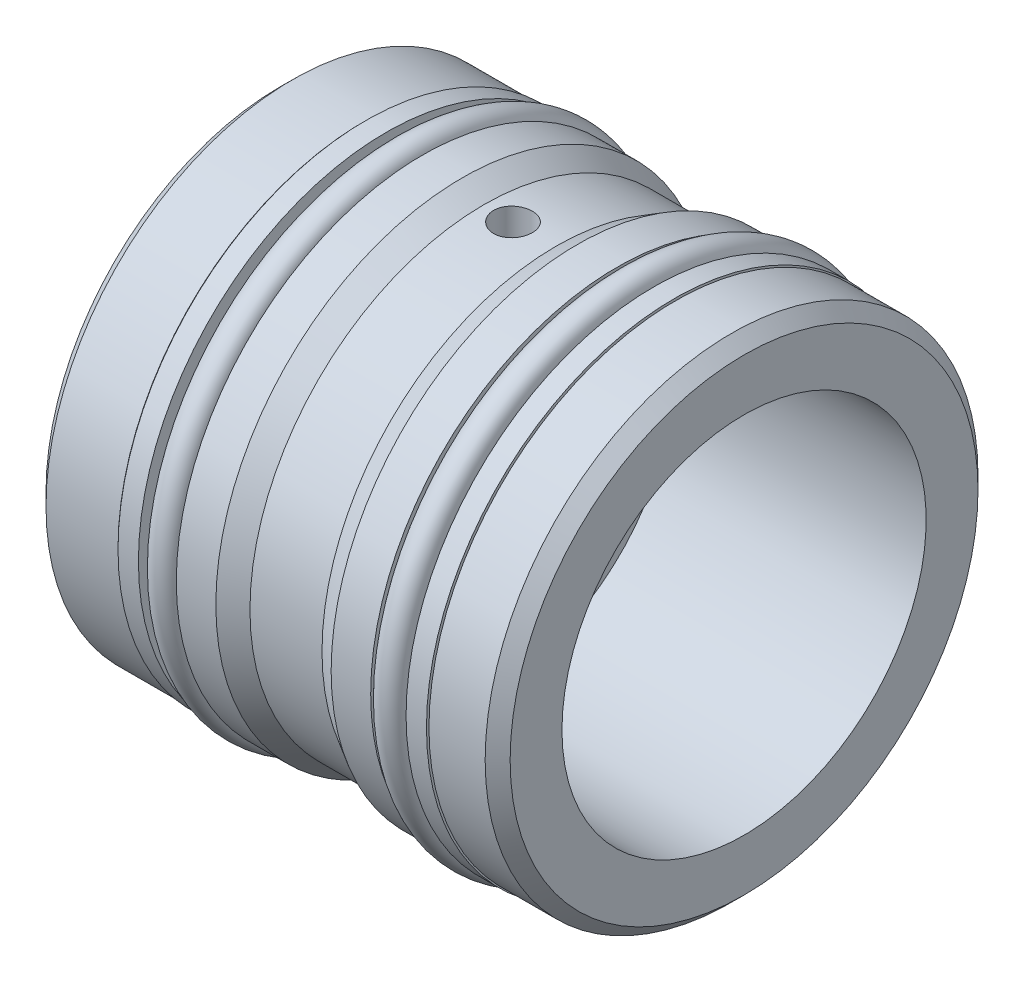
SolidWorks part; units mm, degrees
ref_plane "Front Plane" through (0, 0, 0) normal (0, 0, 1) x (1, 0, 0)
ref_plane "Top Plane" through (0, 0, 0) normal (0, 1, 0) x (1, 0, 0)
ref_plane "Right Plane" through (0, 0, 0) normal (1, 0, 0) x (0, 0, -1)
sketch "Sketch1" plane through (0, 0, 0) normal (0, 0, 1) x (1, 0, 0)
  line L0 (0, 0) -> (0, 45.5562) construction
  line L1 (0, 0) -> (32.8567, 0) construction
  line L2 (-14.1605, 6.35) -> (-14.1605, 15.0368)
  line L3 (-14.1605, 15.0368) -> (-9.0043, 15.0368)
  line L4 (-9.0043, 15.0368) -> (-9.0043, 13.7668)
  line L5 (-9.0043, 13.7668) -> (-5.4483, 13.7668)
  line L6 (-5.4483, 13.7668) -> (-5.4483, 15.0368)
  line L7 (-5.4483, 15.0368) -> (-3.0353, 15.0368)
  line L8 (-3.0353, 15.0368) -> (-3.0353, 14.2748)
  line L9 (-3.0353, 14.2748) -> (4.0005, 14.2748)
  line L10 (-14.1605, 6.35) -> (-1.2319, 6.35)
  line L11 (-1.2319, 6.35) -> (-1.2319, 11.1125)
  line L12 (-1.2319, 11.1125) -> (14.1605, 11.1125)
  line L13 (4.0005, 15.0368) -> (4.0005, 14.2748)
  line L14 (6.4135, 15.0368) -> (4.0005, 15.0368)
  line L15 (6.4135, 13.7668) -> (6.4135, 15.0368)
  line L16 (9.9695, 13.7668) -> (6.4135, 13.7668)
  line L17 (9.9695, 15.0368) -> (9.9695, 13.7668)
  line L18 (14.1605, 15.0368) -> (9.9695, 15.0368)
  line L19 (14.1605, 15.0368) -> (14.1605, 11.1125)
  dimension "D2" = 3.556
  dimension "D3" = 7.0358
  dimension "D4" = 30.0736
  dimension "D5" = 28.321
  dimension "D6" = 22.225
  dimension "D7" = 15.3924
  dimension "D8" = 28.5496
  dimension "D9" = 27.5336
  dimension "D10" = 12.7
  dimension "D11" = 23.1648
  dimension "D12" = 2.413
  dimension "D13" = 2.413
revolve "Revolve1" add sketch "Sketch1" angle 360 about L1
fillet "Fillet1" radius 0.381 2 edges at (4.0005, 0, 14.2748) (-3.0353, 0, 14.2748)
chamfer "Chamfer1" distance 0.762 angle 45 2 edges at (14.1605, 0, 15.0368) (-14.1605, 0, 15.0368)
sketch "Sketch6" plane through (0, 0, 0) normal (0, 0, 1) x (1, 0, 0)
  line L0 (0, 0) -> (49.5791, 0) construction
  line L1 (-14.1605, 14.2748) -> (-14.1605, -14.2748) construction
  line L2 (-5.4483, 13.7668) -> (-9.0043, 13.7668) construction
  line L3 (-8.9281, 13.7668) -> (-7.6835, 13.7668)
  line L4 (-8.9281, 13.7668) -> (-8.9281, 15.113)
  line L5 (-8.9281, 15.113) -> (-7.6835, 15.113)
  line L6 (-7.6835, 13.7668) -> (-7.6835, 15.113)
  line L7 (0.4826, 41.4439) -> (0.4826, -9.3524) construction
  line L8 (-9.0043, -15.0368) -> (-9.0043, 15.0368) construction
  line L9 (9.9695, 13.7668) -> (9.9695, -13.7668) construction
  line L10 (-5.4483, 15.0368) -> (-5.4483, -15.0368) construction
  line L11 (8.6487, 13.7668) -> (8.6487, 15.113)
  line L12 (9.8933, 15.113) -> (8.6487, 15.113)
  line L13 (9.8933, 13.7668) -> (9.8933, 15.113)
  line L14 (9.8933, 13.7668) -> (8.6487, 13.7668)
  circle A0 centre (-6.4135, 14.5796) radius 0.889
  circle A1 centre (7.3787, 14.5796) radius 0.889
  dimension "D4" = 1.778
  dimension "D5" = 29.1592
  dimension "D6" = 0.9652
  dimension "D1" = 1.2446
  dimension "D2" = 5.2324
  dimension "D3" = 30.226
revolve "Revolve3" add sketch "Sketch6" angle 360 about L0
sketch "Sketch7" plane through (0, 0, 0) normal (0, 1, 0) x (0, 0, -1)
  line L1 (-14.2748, -14.1605) -> (14.2748, -14.1605) construction
  circle A0 centre (0, -0.0635) radius 1.1811
  dimension "D1" = 2.3622
  dimension "D2" = 14.097
extrude "Cut-Extrude1" cut sketch "Sketch7" against normal through all and the other way through all
sketch "Sketch8" plane through (0, 0, 0) normal (0, 0, 1) x (1, 0, 0)
  line L0 (0, 0) -> (21.7606, 0) construction
  line L1 (4.0005, 15.0368) -> (2.6807, 14.2748)
  line L2 (3.6195, 14.2748) -> (1.2446, 14.2748) construction
  line L3 (2.6807, 14.2748) -> (4.0005, 14.2748)
  line L4 (4.0005, 14.6558) -> (4.0005, -14.6558) construction
  line L5 (4.0005, 14.2748) -> (4.0005, 15.0368)
  line L6 (0.4826, 15.6879) -> (0.4826, 6.5322) construction
  line L7 (-3.0353, -15.0368) -> (-3.0353, 15.0368) construction
  line L8 (-3.0353, 14.2748) -> (-3.0353, 15.0368)
  line L9 (-1.7155, 14.2748) -> (-3.0353, 14.2748)
  line L10 (-3.0353, 15.0368) -> (-1.7155, 14.2748)
  dimension "D1" = 30
revolve "Revolve4" add sketch "Sketch8" angle 360 about L0
